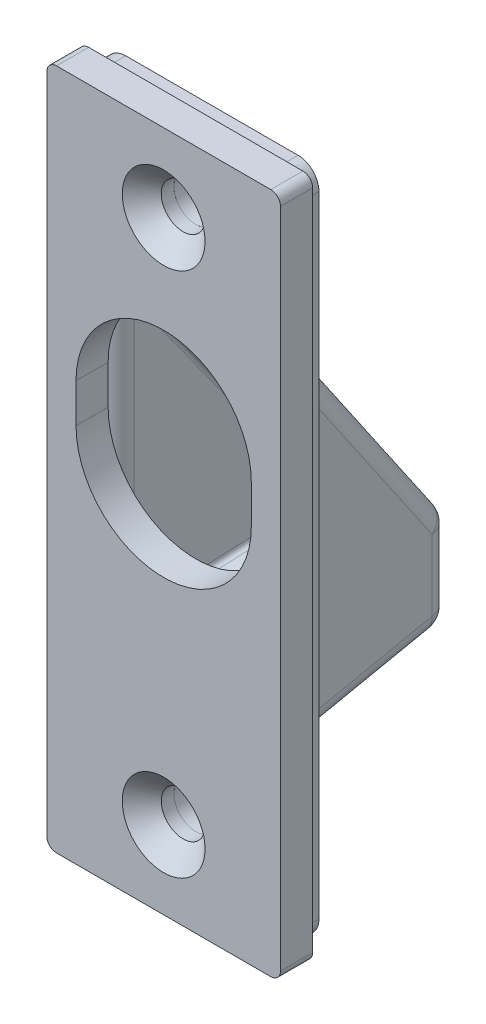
SolidWorks part; units mm, degrees
ref_plane "Front Plane" through (0, 0, 0) normal (0, 0, 1) x (1, 0, 0)
ref_plane "Top Plane" through (0, 0, 0) normal (0, 1, 0) x (1, 0, 0)
ref_plane "Right Plane" through (0, 0, 0) normal (1, 0, 0) x (0, 0, -1)
sketch "Sketch1" plane through (0, 0, 0) normal (1, 0, 0) x (0, 0, -1)
  line L0 (0, 0) -> (-61.7524, 0) construction
  line L1 (0, 34.5) -> (0, -34.5)
  line L2 (1.65, -17) -> (15.312, -15.3225)
  line L3 (17.2, -13.1885) -> (17.2, -5.8856)
  line L4 (16.8112, -4.6524) -> (1.65, 17)
  line L5 (0, 34.5) -> (1.65, 34.5)
  line L6 (1.65, 34.5) -> (1.65, 17)
  line L7 (0, -34.5) -> (1.65, -34.5)
  line L8 (1.65, -34.5) -> (1.65, -17)
  arc A0 (15.312, -15.3225) -> (17.2, -13.1885) centre (15.05, -13.1885) ccw
  arc A1 (17.2, -5.8856) -> (16.8112, -4.6524) centre (15.05, -5.8856) ccw
  point P17 (1.65, 17)
  point P20 (1.65, -17)
  dimension "D7" = 2.15
  dimension "D1" = 17.2
  dimension "D2" = 69
  dimension "D3" = 1.65
  dimension "D4" = 34
  dimension "D5" = 7
  dimension "D6" = 35
extrude "Extrude1" add sketch "Sketch1" along normal mid plane 22 separate body
sketch "Sketch3" plane through (0, 0, 0) normal (0, 1, 0) x (1, 0, 0)
  line L0 (11, 1.65) -> (-11, 1.65) construction
  line L1 (-10, 1.65) -> (-12.5, 1.65)
  line L2 (-10, 1.65) -> (-8.9126, 17.2)
  line L3 (-8.9126, 17.2) -> (-12.5, 17.2)
  line L4 (-12.5, 1.65) -> (-12.5, 17.2)
  line L5 (11, 1.65) -> (-11, 1.65) construction
  line L6 (10, 1.65) -> (12.5, 1.65)
  line L7 (10, 1.65) -> (8.9126, 17.2)
  line L8 (8.9126, 17.2) -> (12.5, 17.2)
  line L9 (12.5, 1.65) -> (12.5, 17.2)
  line L10 (0, 0) -> (0, 20.7966) construction
  line L11 (11, 17.2) -> (-11, 17.2) construction
  dimension "D1" = 4
  dimension "D2" = 20
  dimension "D3" = 25
extrude "Extrude2" cut sketch "Sketch3" against normal through all and the other way through all
fillet "Fillet1" radius 0.5 4 edges at (10, 0, -1.65) (-10, 0, -1.65) (0, 17, -1.65) (0, -17, -1.65)
fillet "Fillet2" radius 2.15 22 edges at (10.1349, -17.1111, -1.7755) (9.9686, -16.9445, -2.1021) (9.5061, -16.1327, -8.7136) (8.9504, -14.6132, -16.6603) (10.3159, 17.0073, -1.6731) (10.0311, 16.6376, -1.9038) (9.4537, 5.8417, -9.4631) (8.9196, -5.2391, -17.1005) (-10.1349, -17.1111, -1.7755) (-9.9686, -16.9445, -2.1021) (-9.5061, -16.1327, -8.7136) (-8.9504, -14.6132, -16.6603) (-10.3159, 17.0073, -1.6731) (-10.0311, 16.6376, -1.9038) (-9.4537, 5.8417, -9.4631) (-8.9196, -5.2391, -17.1005) (8.9126, -9.5371, -17.2) (-8.9126, -9.5371, -17.2) (-11, -34.5, -0.825) (11, -34.5, -0.825) (-11, 34.5, -0.825) (11, 34.5, -0.825)
shell "Shell1" thickness 1.65
sketch "Sketch8" plane through (0, 0, 0) normal (0, 0, 1) x (1, 0, 0)
  line L0 (0, 8) -> (0, 4) construction
  line L1 (-11, 35) -> (11, 35)
  line L2 (-12, 34) -> (-12, -34)
  line L3 (-11, -35) -> (11, -35)
  line L4 (12, 34) -> (12, -34)
  line L5 (-12, 35) -> (12, -35) construction
  line L6 (-12, -35) -> (12, 35) construction
  line L7 (9, 8) -> (9, 4)
  line L8 (-9, 8) -> (-9, 4)
  arc A0 (9, 8) -> (-9, 8) centre (0, 8) ccw
  arc A1 (-9, 4) -> (9, 4) centre (0, 4) ccw
  arc A2 (-11, 35) -> (-12, 34) centre (-11, 34) ccw
  arc A3 (11, 35) -> (12, 34) centre (11, 34) cw
  arc A4 (11, -35) -> (12, -34) centre (11, -34) ccw
  arc A5 (-12, -34) -> (-11, -35) centre (-11, -34) ccw
  point P0 (0, 0)
  point P8 (0, 6)
  point P13 (0, 17)
  point P14 (0, -5)
  dimension "D3" = 9
  dimension "D6" = 1
  dimension "D1" = 24
  dimension "D2" = 70
  dimension "D4" = 18
  dimension "D5" = 22
extrude "Extrude5" add sketch "Sketch8" along normal blind 3.3 separate body
sketch "Sketch11" plane through (0, 0, 0) normal (1, 0, 0) x (0, 0, -1)
  line L0 (-7.351, 27) -> (29.1079, 27) construction
  line L1 (-3.3, 27) -> (-3.3, 31.25)
  line L2 (-3.3, 31.25) -> (-1.3, 29.25)
  line L3 (-1.3, 29.25) -> (11.7, 29.25)
  line L4 (11.7, 29.25) -> (11.7, 27)
  line L5 (11.7, 27) -> (-3.3, 27)
  dimension "D1" = 45
  dimension "D2" = 8.5
  dimension "D3" = 4.5
  dimension "D4" = 3.3
  dimension "D5" = 27
  dimension "D6" = 15
revolve "Cut-Revolve2" cut sketch "Sketch11" angle 360 about L0
mirror "Mirror2" about plane through (0, 0, 0) normal (0, 1, 0) of "Cut-Revolve2"
sketch "Sketch5" [suppressed] plane through (0, 0, 0) normal (1, 0, 0) x (0, 0, -1)
  line L0 (0, 0) -> (-18.2965, 0) construction
  line L1 (0, -49) -> (0, 49)
  line L2 (0, 49) -> (1.65, 49)
  line L3 (1.65, 49) -> (1.65, 29)
  line L4 (1.65, 29) -> (14.7, 24.2502)
  line L5 (14.7, 24.2502) -> (14.7, -24.2502)
  line L6 (14.7, -24.2502) -> (1.65, -29)
  line L7 (1.65, -29) -> (1.65, -49)
  line L8 (1.65, -49) -> (0, -49)
  dimension "D1" = 1.65
  dimension "D2" = 98
  dimension "D3" = 58
  dimension "D4" = 14.7
  dimension "D5" = 70
extrude "Extrude3" [suppressed] add sketch "Sketch5" along normal mid plane 22 separate body
sketch "Sketch7" [suppressed] plane through (0, 0, 0) normal (0, 1, 0) x (1, 0, 0)
  line L0 (0, 0) -> (0, 16.399) construction
  line L1 (11, 1.65) -> (-11, 1.65) construction
  line L2 (10, 1.65) -> (12.5, 1.65)
  line L3 (10, 1.65) -> (8.8583, 14.7)
  line L4 (8.8583, 14.7) -> (12.5, 14.7)
  line L5 (12.5, 1.65) -> (12.5, 14.7)
  line L6 (11, 1.65) -> (-11, 1.65) construction
  line L7 (-10, 1.65) -> (-12.5, 1.65)
  line L8 (-10, 1.65) -> (-8.8583, 14.7)
  line L9 (-8.8583, 14.7) -> (-12.5, 14.7)
  line L10 (-12.5, 1.65) -> (-12.5, 14.7)
  line L11 (11, 14.7) -> (-11, 14.7) construction
  dimension "D1" = 25
  dimension "D2" = 20
  dimension "D3" = 5
extrude "Extrude4" [suppressed] cut sketch "Sketch7" against normal mid plane 122
fillet "Fillet3" [suppressed] radius 2.15
fillet "Fillet4" [suppressed] radius 2.15
fillet "Fillet5" [suppressed] radius 0.5
shell "Shell2" [suppressed] thickness 1.65
sketch "Sketch9" [suppressed] plane through (0, 0, 0) normal (0, 0, 1) x (1, 0, 0)
  line L0 (0, 19) -> (0, -19) construction
  line L1 (-11, 50) -> (11, 50)
  line L2 (-12, 49) -> (-12, -49)
  line L3 (-11, -50) -> (11, -50)
  line L4 (12, 49) -> (12, -49)
  line L5 (-12, 50) -> (12, -50) construction
  line L6 (-12, -50) -> (12, 50) construction
  line L7 (9, 19) -> (9, 5)
  line L8 (-9, 19) -> (-9, 5)
  line L9 (-9, 5) -> (9, 5)
  line L10 (-9, -5) -> (9, -5)
  line L11 (0, 0) -> (19.628, 0) construction
  line L12 (-9, -5) -> (-9, -19)
  line L13 (9, -5) -> (9, -19)
  arc A0 (-11, 50) -> (-12, 49) centre (-11, 49) ccw
  arc A1 (11, 50) -> (12, 49) centre (11, 49) cw
  arc A2 (11, -50) -> (12, -49) centre (11, -49) ccw
  arc A3 (-12, -49) -> (-11, -50) centre (-11, -49) ccw
  arc A4 (9, 19) -> (-9, 19) centre (0, 19) ccw
  arc A5 (-9, -19) -> (9, -19) centre (0, -19) ccw
  point P0 (0, 0)
  point P20 (0, 0)
  point P31 (0, 28)
  point P32 (0, -28)
  dimension "D3" = 1
  dimension "D4" = 9
  dimension "D1" = 24
  dimension "D2" = 100
  dimension "D5" = 56
  dimension "D6" = 10
extrude "Extrude6" [suppressed] add sketch "Sketch9" along normal blind 3.3 separate body
sketch "Sketch10" [suppressed] plane through (0, 0, 0) normal (1, 0, 0) x (0, 0, -1)
  line L0 (-5.3899, 40) -> (9.7749, 40) construction
  line L1 (-3.3, 40) -> (-3.3, 44.25)
  line L2 (-3.3, 44.25) -> (-1.3, 42.25)
  line L3 (-1.3, 42.25) -> (11.7, 42.25)
  line L4 (11.7, 42.25) -> (11.7, 40)
  line L5 (11.7, 40) -> (-3.3, 40)
  dimension "D1" = 45
  dimension "D2" = 8.5
  dimension "D3" = 4.5
  dimension "D4" = 3.3
  dimension "D5" = 40
  dimension "D6" = 15
revolve "Cut-Revolve1" [suppressed] cut sketch "Sketch10" angle 360 about L0
mirror "Mirror1" [suppressed] about plane through (0, 0, 0) normal (0, 1, 0)
